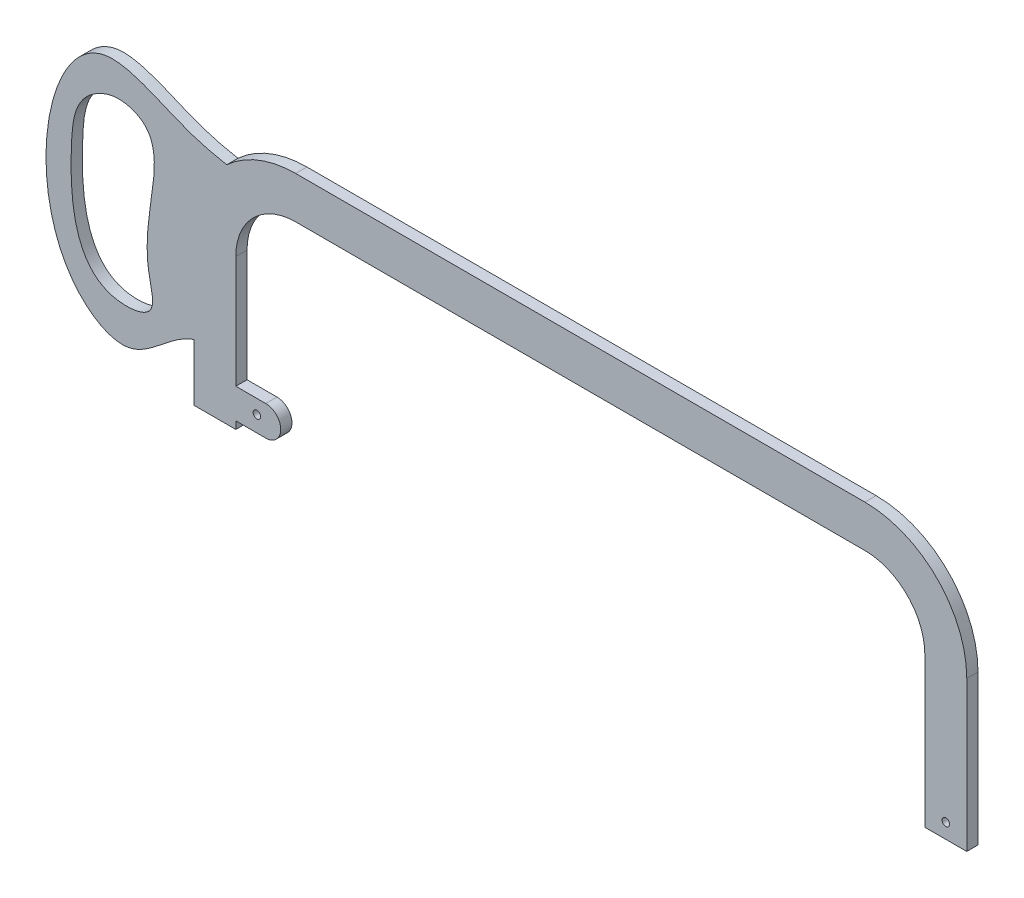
SolidWorks part; units mm, degrees
ref_plane "Front Plane" through (0, 0, 0) normal (0, 0, 1) x (1, 0, 0)
ref_plane "Top Plane" through (0, 0, 0) normal (0, 1, 0) x (1, 0, 0)
ref_plane "Right Plane" through (0, 0, 0) normal (1, 0, 0) x (0, 0, -1)
sketch "Sketch2" plane through (0, 0, 0) normal (0, 0, 1) x (1, 0, 0)
  line L0 (-176.2528, 0) -> (-176.2528, 63.5)
  line L1 (-150.8528, 88.9) -> (90.4472, 88.9)
  line L2 (115.8472, 63.5) -> (115.8472, 0)
  line L3 (115.8472, 0) -> (133.6272, 0)
  line L4 (133.6272, 0) -> (133.6272, 63.5)
  line L5 (90.4472, 106.68) -> (-150.8528, 106.68)
  line L6 (-194.0328, 63.5) -> (-194.0328, 0)
  line L7 (-194.0328, 0) -> (-176.2528, 0)
  arc A0 (-176.2528, 63.5) -> (-150.8528, 88.9) centre (-150.8528, 63.5) cw
  arc A1 (115.8472, 63.5) -> (90.4472, 88.9) centre (90.4472, 63.5) ccw
  arc A2 (-194.0328, 63.5) -> (-150.8528, 106.68) centre (-150.8528, 63.5) cw
  arc A3 (133.6272, 63.5) -> (90.4472, 106.68) centre (90.4472, 63.5) ccw
  dimension "D4" = 63.5
  dimension "D1" = 17.78
  dimension "D2" = 17.78
  dimension "D3" = 241.3
extrude "Extrude1" add sketch "Sketch2" along normal mid plane 4.7625
sketch "Sketch4" plane through (0, 0, 2.3813) normal (0, 0, 1) x (1, 0, 0)
  line L0 (-176.2528, 3.175) -> (-163.5528, 3.175)
  line L1 (-176.2528, 0) -> (-176.2528, 63.5) construction
  line L2 (-176.2528, 15.875) -> (-163.5528, 15.875)
  line L3 (-194.0328, 0) -> (-176.2528, 0) construction
  line L4 (-176.2528, 15.875) -> (-176.2528, 3.175)
  arc A0 (-163.5528, 3.175) -> (-163.5528, 15.875) centre (-163.5528, 9.525) ccw
  dimension "D1" = 12.7
  dimension "D2" = 3.175
  dimension "D3" = 12.7
extrude "Extrude2" add sketch "Sketch4" against normal up to surface (4.7625 mm away)
sketch "Sketch5" plane through (0, 0, 2.3813) normal (0, 0, 1) x (1, 0, 0)
  line L0 (133.6272, 0) -> (133.6272, 63.5) construction
  circle A0 centre (-167.3363, 9.9386) radius 1.5875
  circle A1 centre (124.7372, 6.35) radius 1.5875
  arc A2 (115.8472, 63.5) -> (90.4472, 88.9) centre (90.4472, 63.5) ccw construction
  point P4 (90.4472, 63.5)
  dimension "D1" = 3.175
  dimension "D2" = 57.15
  dimension "D3" = 8.89
extrude "Cut-Extrude1" cut sketch "Sketch5" against normal through all
sketch "Sketch6" plane through (0, 0, 2.3813) normal (0, 0, 1) x (1, 0, 0)
  line L1 (-163.5001, 92.9767) -> (-185.371, 71.1058)
  line L2 (-185.371, 71.1058) -> (-185.371, 24.5413)
  point P1 (-196.0042, 99.3713)
  point P2 (-249.3752, 94.5849)
  point P3 (-231.117, 109.7618)
  point P4 (-241.012, 88.8095)
  point P5 (-244.0155, 18.3969)
  point P6 (-245.9455, 69.5043)
  point P7 (-222.1596, 7.2898)
  point P9 (-189.9132, 24.8462)
  point P10 (-227.0693, 22.5284)
  point P13 (-212.6977, 25.4677)
  point P19 (-213.3412, 40.7611)
  point P21 (-217.8458, 94.5849)
  point P23 (-225.9968, 96.5315)
extrude "Extrude3" add sketch "Sketch6" against normal up to surface (4.7625 mm away)
